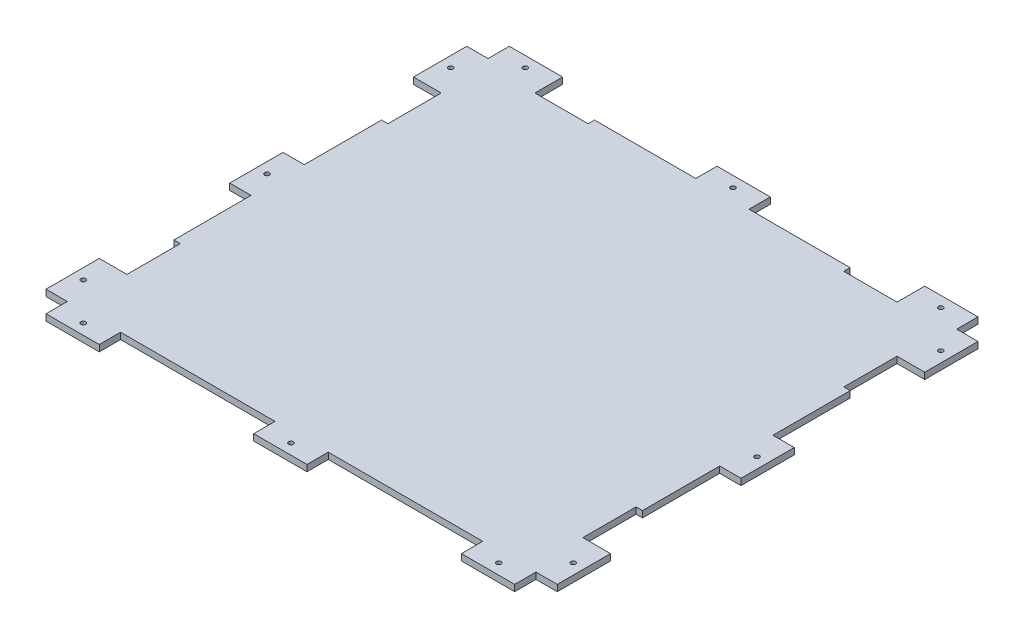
SolidWorks part; units mm, degrees
ref_plane "Ebene vorne" through (0, 0, 0) normal (0, 0, 1) x (1, 0, 0)
ref_plane "Ebene oben" through (0, 0, 0) normal (0, 1, 0) x (1, 0, 0)
ref_plane "Ebene rechts" through (0, 0, 0) normal (1, 0, 0) x (0, 0, -1)
sketch "Skizze1" plane through (0, 0, 0) normal (0, 1, 0) x (1, 0, 0)
  line L0 (0, 263.3846) -> (0, -263.3846) construction
  line L1 (-220, 217.5) -> (-170, 217.5)
  line L2 (-240, 197.5) -> (-240, 147.5)
  line L3 (214, 97.5) -> (220, 97.5)
  line L4 (120, 197.5) -> (120, 191.5)
  line L5 (-377.5956, 0) -> (377.5956, 0) construction
  line L6 (-170, 197.5) -> (-170, 191.5)
  line L7 (-240, 25) -> (-240, -25)
  line L8 (170, 191.5) -> (120, 191.5)
  line L9 (-240, 197.5) -> (-220, 197.5)
  line L10 (-220, 217.5) -> (-220, 197.5)
  line L11 (214, 147.5) -> (214, 97.5)
  line L12 (-170, 217.5) -> (-170, 197.5)
  line L13 (-120, 197.5) -> (-25, 197.5)
  line L14 (-25, 217.5) -> (-25, 197.5)
  line L15 (-240, 147.5) -> (-220, 147.5)
  line L16 (220, 147.5) -> (214, 147.5)
  line L17 (-240, 25) -> (-220, 25)
  line L18 (-220, 97.5) -> (-220, 25)
  line L19 (-220, 147.5) -> (-214, 147.5)
  line L20 (-214, 147.5) -> (-214, 97.5)
  line L21 (-170, 191.5) -> (-120, 191.5)
  line L22 (-120, 197.5) -> (-120, 191.5)
  line L23 (-214, 97.5) -> (-220, 97.5)
  line L24 (-25, 217.5) -> (25, 217.5)
  line L25 (220, 97.5) -> (220, 25)
  line L26 (240, 25) -> (220, 25)
  line L27 (240, 147.5) -> (220, 147.5)
  line L28 (25, 217.5) -> (25, 197.5)
  line L29 (120, 197.5) -> (25, 197.5)
  line L30 (170, 217.5) -> (170, 197.5)
  line L31 (220, 217.5) -> (220, 197.5)
  line L32 (240, 197.5) -> (220, 197.5)
  line L33 (240, 25) -> (240, -25)
  line L34 (170, 197.5) -> (170, 191.5)
  line L35 (240, 197.5) -> (240, 147.5)
  line L36 (220, 217.5) -> (170, 217.5)
  line L37 (220, -217.5) -> (170, -217.5)
  line L38 (240, -197.5) -> (240, -147.5)
  line L39 (120, -197.5) -> (170, -197.5)
  line L40 (240, -197.5) -> (220, -197.5)
  line L41 (220, -217.5) -> (220, -197.5)
  line L42 (170, -217.5) -> (170, -197.5)
  line L43 (120, -197.5) -> (25, -197.5)
  line L44 (25, -217.5) -> (25, -197.5)
  line L45 (240, -147.5) -> (220, -147.5)
  line L46 (240, -25) -> (220, -25)
  line L47 (220, -97.5) -> (220, -25)
  line L48 (-25, -217.5) -> (25, -217.5)
  line L49 (-214, -97.5) -> (-220, -97.5)
  line L50 (-170, -197.5) -> (-120, -197.5)
  line L52 (-214, -147.5) -> (-214, -97.5)
  line L53 (-220, -147.5) -> (-214, -147.5)
  line L54 (-220, -97.5) -> (-220, -25)
  line L55 (-240, -25) -> (-220, -25)
  line L56 (220, -147.5) -> (214, -147.5)
  line L57 (-240, -147.5) -> (-220, -147.5)
  line L58 (-25, -217.5) -> (-25, -197.5)
  line L59 (-120, -197.5) -> (-25, -197.5)
  line L60 (-170, -217.5) -> (-170, -197.5)
  line L61 (214, -147.5) -> (214, -97.5)
  line L62 (-220, -217.5) -> (-220, -197.5)
  line L63 (-240, -197.5) -> (-220, -197.5)
  line L67 (214, -97.5) -> (220, -97.5)
  line L68 (-240, -197.5) -> (-240, -147.5)
  line L69 (-220, -217.5) -> (-170, -217.5)
  point P3 (0, 217.5)
  point P42 (0, -217.5)
  point P50 (240, 0)
  point P77 (-240, 0)
  dimension "D2" = 480
  dimension "D3" = 20
  dimension "D4" = 20
  dimension "D5" = 50
  dimension "D6" = 25
  dimension "D7" = 50
  dimension "D8" = 25
  dimension "D9" = 6
  dimension "D10" = 50
  dimension "D11" = 6
  dimension "D12" = 50
  dimension "D13" = 435
extrude "Aufsatz-Linear austragen1" add sketch "Skizze1" along normal blind 6 contours L2 L15 L19 L20 L23 L18 L17 L7 L55 L54 L49 L52 L53 L57 L68 L63 L62 L69 L60 L50 L59 L58 L48 L44 L43 L39 L42 L37 L41 L40 L38 L45 L56 L61 L67 L47 L46 L33 L26 L25 L3 L11 L16 L27 L35 L32 L31 L36 L30 L34 L8 L4 L29 L28 L24 L14 L13 L22 L21 L6 L12 L1 L10 L9
sketch "Skizze2" plane through (0, 6, 0) normal (0, 1, 0) x (1, 0, 0)
  line L0 (-220, 207.5) -> (-170, 207.5) construction
  line L1 (-220, 217.5) -> (-220, 197.5) construction
  line L2 (-170, 217.5) -> (-170, 191.5) construction
  line L3 (-195, 217.5) -> (-195, -217.5) construction
  line L4 (-220, 217.5) -> (-170, 217.5) construction
  line L5 (-220, -217.5) -> (-170, -217.5) construction
  line L6 (-240, 172.5) -> (-220, 172.5) construction
  line L7 (-240, 197.5) -> (-240, 147.5) construction
  line L8 (-230, 197.5) -> (-230, 147.5) construction
  line L9 (-240, 197.5) -> (-220, 197.5) construction
  line L10 (-240, 147.5) -> (-214, 147.5) construction
  line L11 (0, 217.5) -> (0, -217.5) construction
  line L12 (-25, 217.5) -> (25, 217.5) construction
  line L13 (-25, -217.5) -> (25, -217.5) construction
  line L14 (-25, 207.5) -> (25, 207.5) construction
  line L15 (-25, 217.5) -> (-25, 197.5) construction
  line L16 (25, 217.5) -> (25, 197.5) construction
  line L17 (-240, 0) -> (240, 0) construction
  line L18 (-240, 25) -> (-240, -25) construction
  line L19 (240, 25) -> (240, -25) construction
  line L20 (-230, 25) -> (-230, -25) construction
  line L21 (-240, 25) -> (-220, 25) construction
  line L22 (-240, -25) -> (-220, -25) construction
  circle A0 centre (-195, 207.5) radius 2.2
  circle A1 centre (-230, 172.5) radius 2.2
  circle A2 centre (230, 172.5) radius 2.2
  circle A3 centre (195, 207.5) radius 2.2
  circle A4 centre (0, 207.5) radius 2.2
  circle A5 centre (0, -207.5) radius 2.2
  circle A6 centre (-230, -172.5) radius 2.2
  circle A7 centre (-195, -207.5) radius 2.2
  circle A8 centre (195, -207.5) radius 2.2
  circle A9 centre (230, -172.5) radius 2.2
  circle A10 centre (-230, 0) radius 2.2
  circle A11 centre (230, 0) radius 2.2
  dimension "D1" = 4.4
extrude "Schnitt-Linear austragen1" cut sketch "Skizze2" against normal through all
